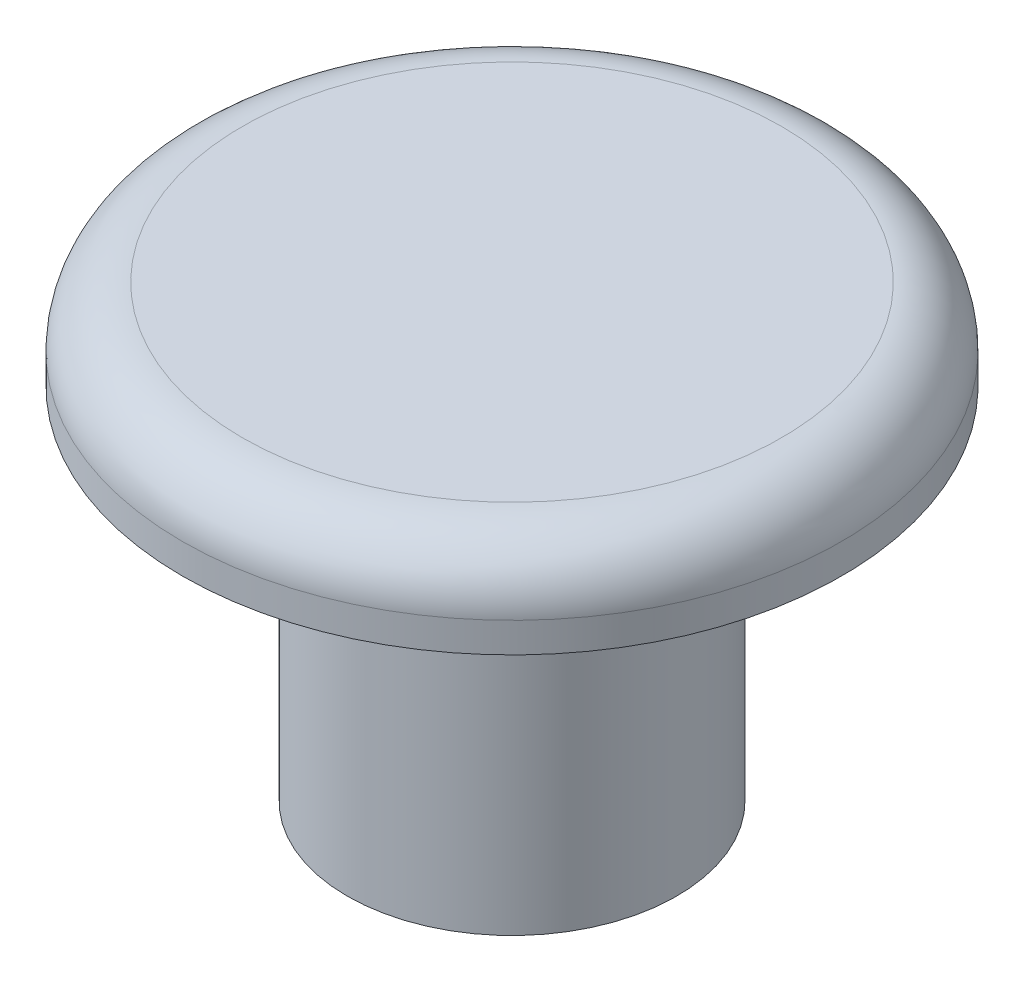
SolidWorks part; units mm, degrees
ref_plane "Front Plane" through (0, 0, 0) normal (0, 0, 1) x (1, 0, 0)
ref_plane "Top Plane" through (0, 0, 0) normal (0, 1, 0) x (1, 0, 0)
ref_plane "Right Plane" through (0, 0, 0) normal (1, 0, 0) x (0, 0, -1)
sketch "Sketch1" plane through (0, 0, 0) normal (0, 1, 0) x (1, 0, 0)
  circle A0 centre (0, 0) radius 5.5
  dimension "D1" = 11
extrude "Boss-Extrude1" add sketch "Sketch1" along normal blind 12
sketch "Sketch2" plane through (0, 12, 0) normal (0, 1, 0) x (1, 0, 0)
  circle A0 centre (0, 0) radius 11
  dimension "D1" = 22
extrude "Boss-Extrude2" add sketch "Sketch2" along normal blind 3
fillet "Fillet1" radius 2 1 edges at (0, 15, 11)
